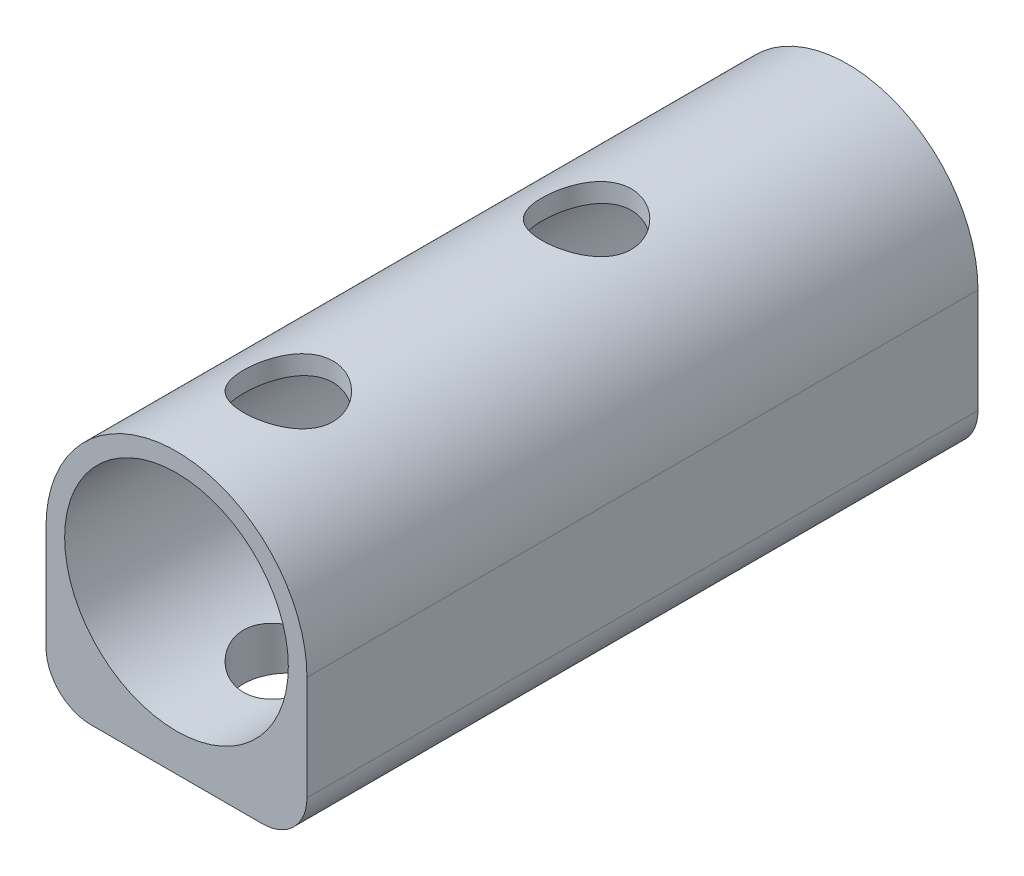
SolidWorks part; units mm, degrees
ref_plane "Plane1" through (0, 0, 0) normal (0, 0, 1) x (1, 0, 0)
ref_plane "Plane2" through (0, 0, 0) normal (0, 1, 0) x (1, 0, 0)
ref_plane "Plane3" through (0, 0, 0) normal (1, 0, 0) x (0, 0, -1)
sketch "Sketch1" plane through (0, 0, 0) normal (0, 0, 1) x (1, 0, 0)
  line L0 (-17.5, -20) -> (-17.5, 0)
  line L1 (17.5, 0) -> (17.5, -20)
  line L2 (17.5, -20) -> (-17.5, -20)
  arc A0 (-17.5, 0) -> (17.5, 0) centre (0, 0) cw
  dimension "D1" = 20
  dimension "Outer_D" = 35
extrude "Base-Extrude" add sketch "Sketch1" along normal blind 90
sketch "Sketch2" plane through (0, 0, 90) normal (0, 0, 1) x (1, 0, 0)
  circle A0 centre (0, 0) radius 15
  dimension "Inner_D" = 30
extrude "Cut-Extrude1" cut sketch "Sketch2" against normal through all
sketch "Sketch3" plane through (0, -20, 0) normal (0, -1, 0) x (1, 0, 0)
  line L0 (17.5, 90) -> (-17.5, 90) construction
  line L3 (17.5, 90) -> (-17.5, 90) construction
  circle A0 centre (0, 35) radius 6
  circle A1 centre (0, 75) radius 6
  dimension "D2" = 12
  dimension "Hole1" = 15
  dimension "Hole2" = 55
extrude "Cut-Extrude2" cut sketch "Sketch3" against normal through all
fillet "Fillet1" radius 6 2 edges at (17.5, -20, 45) (-17.5, -20, 45)
